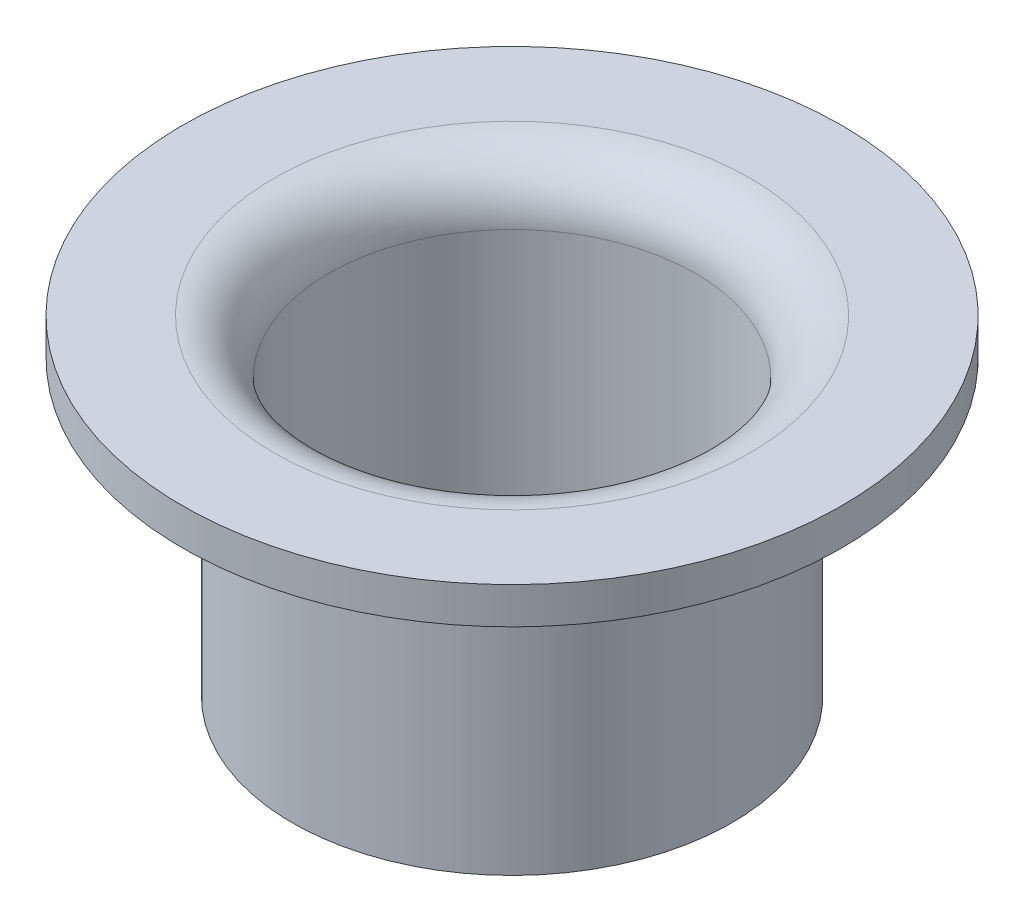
SolidWorks part; units mm, degrees
ref_plane "Face" through (0, 0, 0) normal (0, 0, 1) x (1, 0, 0)
ref_plane "Dessus" through (0, 0, 0) normal (0, 1, 0) x (1, 0, 0)
ref_plane "Droite" through (0, 0, 0) normal (1, 0, 0) x (0, 0, -1)
sketch "Esquisse2" plane through (0, 0, 0) normal (0, 0, 1) x (1, 0, 0)
  line L0 (6, 30.6455) -> (5, 30.6455)
  line L1 (0, 0) -> (0, 58.7177) construction
  line L2 (5, 30.6455) -> (5, 38.1455)
  line L3 (6.5, 39.6455) -> (9, 39.6455)
  line L4 (9, 39.6455) -> (9, 38.6455)
  line L6 (9, 38.6455) -> (6.5, 38.6455)
  line L7 (6, 38.1455) -> (6, 30.6455)
  arc A0 (6.5, 38.6455) -> (6, 38.1455) centre (6.5, 38.1455) ccw
  arc A1 (5, 38.1455) -> (6.5, 39.6455) centre (6.5, 38.1455) cw
  point P7 (6, 38.6455)
  dimension "D6" = 0.5
  dimension "D1" = 6
  dimension "D2" = 5
  dimension "D3" = 9
  dimension "D4" = 9
revolve "Révolution1" add sketch "Esquisse2" angle 360 about L1
